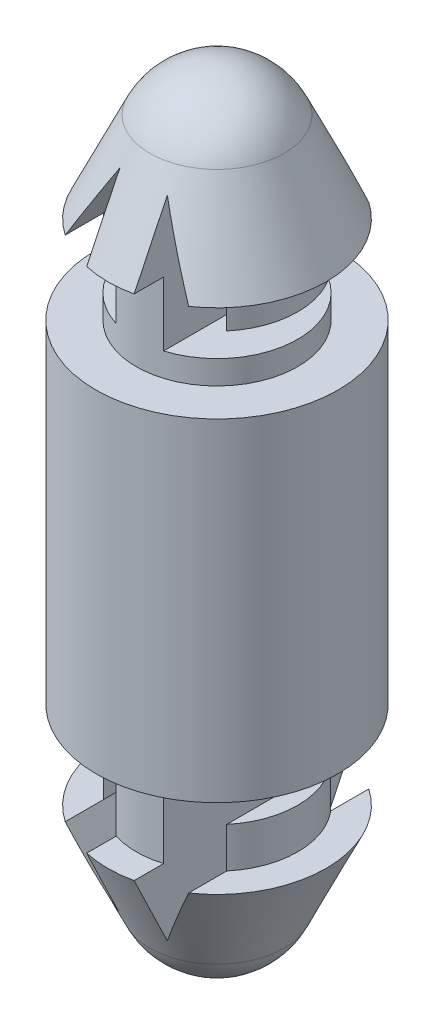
SolidWorks part; units mm, degrees
ref_plane "Front" through (0, 0, 0) normal (0, 0, 1) x (1, 0, 0)
ref_plane "Top" through (0, 0, 0) normal (0, 1, 0) x (1, 0, 0)
ref_plane "Right" through (0, 0, 0) normal (1, 0, 0) x (0, 0, -1)
sketch "Эскиз1" plane through (0, 0, 0) normal (0, 0, 1) x (1, 0, 0)
  line L0 (0, -4.65) -> (0, 11.65) construction
  line L1 (1.7, -1.85) -> (2.3, -1.85)
  line L2 (2.3, -1.85) -> (1.4146, -3.7488)
  line L3 (1.7, 7) -> (1.7, 8.85)
  line L4 (1.7, 8.85) -> (2.3, 8.85)
  line L5 (1.7, 0) -> (2.55, 0)
  line L6 (2.55, 0) -> (2.55, 7)
  line L7 (2.55, 7) -> (1.7, 7)
  line L8 (2.3, 8.85) -> (1.4146, 10.7488)
  line L9 (0, -4.65) -> (0, 11.65)
  line L11 (1.7, -1.85) -> (1.7, 0)
  line L12 (0, -4.65) -> (0, 11.65) construction
  arc A0 (1.4146, -3.7488) -> (0, -4.65) centre (0, -3.0892) cw
  arc A1 (1.4146, 10.7488) -> (0, 11.65) centre (0, 10.0892) ccw
  dimension "D1" = 1.85
  dimension "D2" = 4.65
  dimension "D3" = 5.1
  dimension "D4" = 3.4
  dimension "D5" = 4.6
  dimension "D6" = 25
  dimension "H" = 7
  dimension "D8" = 4.65
  dimension "D9" = 1.85
revolve "Повернуть1" add sketch "Эскиз1" angle 360 about L0
sketch "Эскиз2" plane through (0, 0, 0) normal (0, 0, 1) x (1, 0, 0)
  line L1 (0, 0) -> (0, 7) construction
  line L2 (-1.7, 0) -> (1.7, 0) construction
  line L3 (2.55, 7) -> (-2.55, 7) construction
  line L4 (-2.55, -0.5) -> (-0.5, -0.5)
  line L8 (-0.5, -0.5) -> (-0.5, -3.3)
  line L9 (-0.5, -3.3) -> (-1.3, -1.85)
  line L10 (2.3, -1.85) -> (-2.3, -1.85) construction
  line L11 (-1.3, -1.85) -> (-1.3, -1)
  line L12 (-1.3, -1) -> (-2.55, -1)
  line L13 (-2.55, -1) -> (-2.55, -0.5)
  line L15 (-2.55, 3.5) -> (2.55, 3.5) construction
  line L16 (-2.55, 7) -> (-2.55, 0) construction
  line L17 (2.55, 0) -> (2.55, 7) construction
  line L18 (2.55, -1) -> (2.55, -0.5)
  line L19 (1.3, -1) -> (2.55, -1)
  line L20 (1.3, -1.85) -> (1.3, -1)
  line L21 (0.5, -3.3) -> (1.3, -1.85)
  line L22 (0.5, -0.5) -> (0.5, -3.3)
  line L23 (2.55, -0.5) -> (0.5, -0.5)
  line L24 (2.55, 7.5) -> (0.5, 7.5)
  line L25 (0.5, 7.5) -> (0.5, 10.3)
  line L26 (0.5, 10.3) -> (1.3, 8.85)
  line L27 (1.3, 8.85) -> (1.3, 8)
  line L28 (1.3, 8) -> (2.55, 8)
  line L29 (2.55, 8) -> (2.55, 7.5)
  line L30 (-2.55, 8) -> (-2.55, 7.5)
  line L31 (-1.3, 8) -> (-2.55, 8)
  line L32 (-1.3, 8.85) -> (-1.3, 8)
  line L33 (-0.5, 10.3) -> (-1.3, 8.85)
  line L34 (-0.5, 7.5) -> (-0.5, 10.3)
  line L35 (-2.55, 7.5) -> (-0.5, 7.5)
  dimension "D1" = 0.5
  dimension "D2" = 0.5
  dimension "D3" = 0.8
  dimension "D4" = 1
  dimension "D5" = 2.8
extrude "Вытянуть1" cut sketch "Эскиз2" against normal through all and the other way through all
